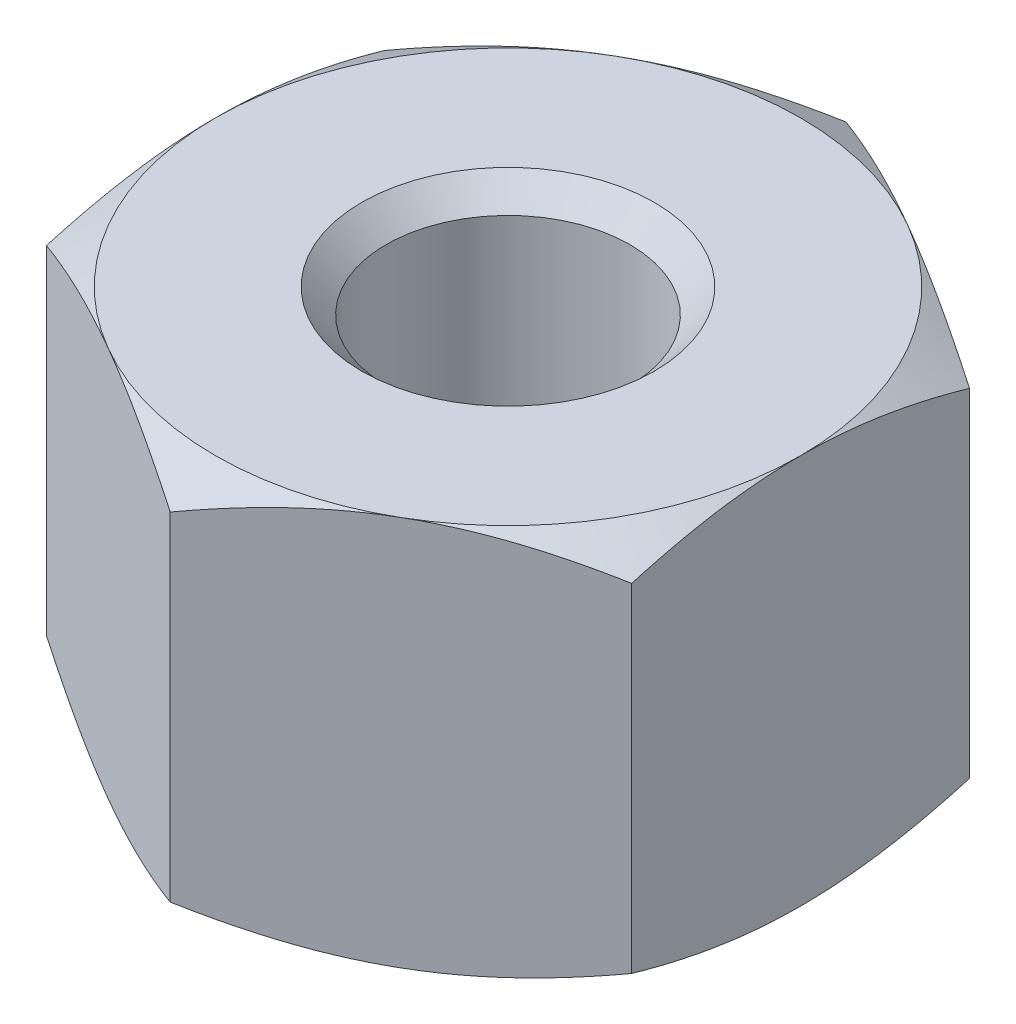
SolidWorks part; units mm, degrees
ref_plane "Front Plane" through (0, 0, 0) normal (0, 0, 1) x (1, 0, 0)
ref_plane "Top Plane" through (0, 0, 0) normal (0, 1, 0) x (1, 0, 0)
ref_plane "Right Plane" through (0, 0, 0) normal (1, 0, 0) x (0, 0, -1)
sketch "Sketch1" plane through (0, 0, 0) normal (0, 1, 0) x (1, 0, 0)
  line L1 (3, -1.7321) -> (3, 1.7321)
  line L2 (3, 1.7321) -> (0, 3.4641)
  line L3 (0, 3.4641) -> (-3, 1.7321)
  line L4 (-3, 1.7321) -> (-3, -1.7321)
  line L5 (-3, -1.7321) -> (0, -3.4641)
  line L6 (0, -3.4641) -> (3, -1.7321)
  circle A0 centre (0, 0) radius 3 construction
  dimension "D1" = 6
extrude "Boss-Extrude1" add sketch "Sketch1" along normal mid plane 4
sketch "Sketch2" plane through (0, 2, 0) normal (0, 1, 0) x (1, 0, 0)
  line L0 (3, 1.7321) -> (0, 3.4641) construction
  circle A0 centre (0, 0) radius 3
extrude "Cut-Extrude1" cut sketch "Sketch2" against normal blind 2.4 draft 60 flip side to cut
mirror "Mirror1" about plane through (0, 0, 0) normal (0, 1, 0) of "Cut-Extrude1"
hole_wizard " Tapped Hole2" positions "Sketch3" profile "Sketch4" tap size "M3" standard "ISO"
sketch "Sketch3" plane through (0, -2, 0) normal (0, -1, 0) x (-1, 0, 0)
  point P0 (0, 0)
sketch "Sketch4" plane through (0, -2, 0) normal (1, 0, 0) x (0, 0, -1)
  line L0 (0, 0) -> (0, 4)
  line L1 (0, 4) -> (1.25, 4)
  line L2 (1.25, 4) -> (1.25, 0)
  line L5 (1.25, 0) -> (0, 0)
  line L11 (0, -6.35) -> (0, 107.95) construction
  dimension "Thru Tap Drill Dia." = 2.5
  dimension "Thru Tap Drill Depth" = 4
chamfer "Chamfer1" distance 0.25 angle 45 2 edges at (0, 2, 1.25) (0, -2, -1.25)
